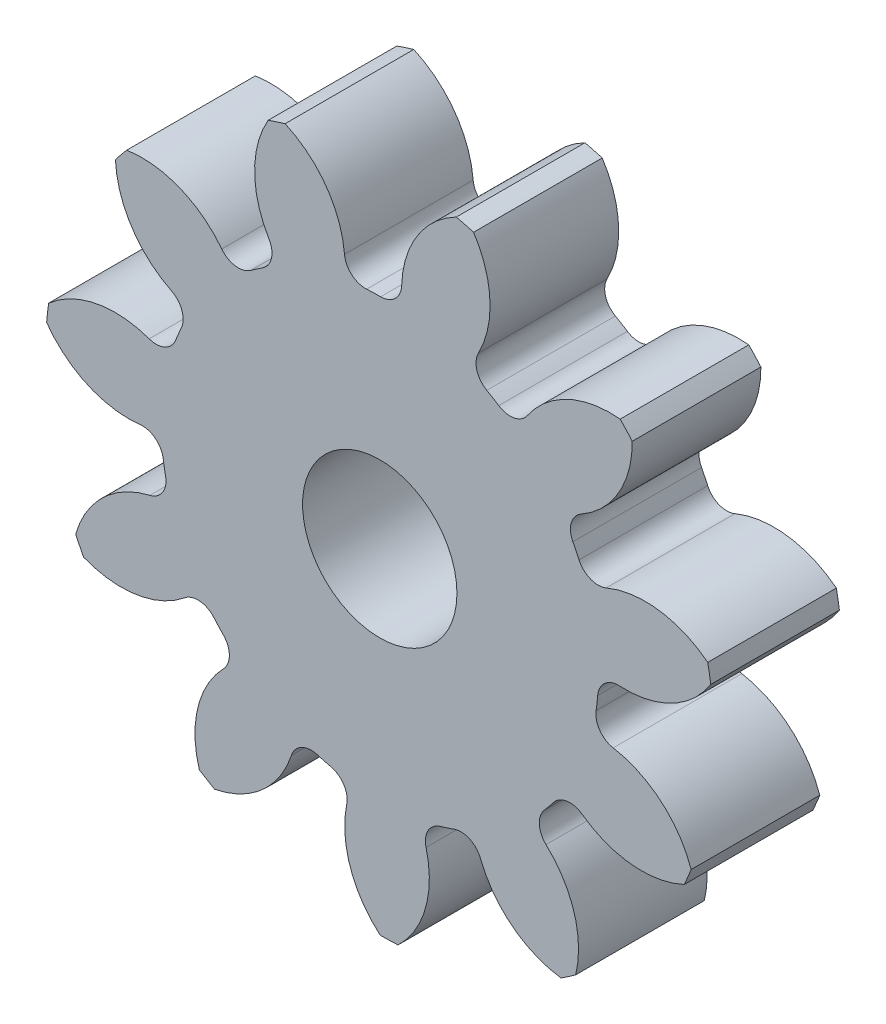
SolidWorks part; units mm, degrees
ref_plane "Front" through (0, 0, 0) normal (0, 0, 1) x (1, 0, 0)
ref_plane "Top" through (0, 0, 0) normal (0, 1, 0) x (1, 0, 0)
ref_plane "Right" through (0, 0, 0) normal (1, 0, 0) x (0, 0, -1)
sketch "Sketch3" plane through (0, 0, 0) normal (0, 0, 1) x (1, 0, 0)
  circle A0 centre (0, 0) radius 330.2
  dimension "od" = 660.4
extrude "gearBody" add sketch "Sketch3" along normal blind 127
sketch "Sketch2" plane through (0, 0, 0) normal (0, 0, 1) x (1, 0, 0)
  line L0 (0, 0) -> (242.5647, 100.4736) construction
  line L1 (309.4034, -127.0438) -> (0, 0) construction
  line L2 (0, 0) -> (36.3143, 0) construction
  line L3 (279.2866, 7.9593) -> (270.1426, -71.3254) construction
  line L5 (274.7146, -31.6831) -> (0, 0) construction
  line L7 (0, 0) -> (262.5501, 0) construction
  arc A0 (262.5334, 2.9613) -> (254.967, -62.6451) centre (0, 0) ccw construction
  arc A1 (326.7783, 47.4127) -> (307.4066, -120.5538) centre (0, 0) ccw construction
  arc A2 (279.2866, 7.9593) -> (270.1426, -71.3254) centre (0, 0) ccw construction
  arc A3 (213.5736, -31.6091) -> (215.1619, -17.8374) centre (0, 0) ccw
  arc A4 (309.4034, -127.0438) -> (230.466, -55.0028) centre (213.3254, -153.0518) ccw
  arc A5 (309.4034, -127.0438) -> (330.2, 53.2778) centre (0, 0) ccw
  arc A6 (330.2, 53.2778) -> (236.936, 1.097) centre (242.5647, 100.4736) cw
  arc A7 (215.1619, -17.8374) -> (236.936, 1.097) centre (235.7668, -19.5456) cw
  arc A8 (230.466, -55.0028) -> (213.5736, -31.6091) centre (234.0264, -34.6361) cw
  point P6 (330.2, 53.2778)
  point P22 (309.4034, -127.0438)
  dimension "baseDia" = 525.1002
  dimension "od" = 660.4
  dimension "pd" = 558.8
  dimension "rd" = 431.8
  dimension "rFillet" = 20.6756
  dimension "pointX" = 330.2
  dimension "pointY" = 53.2778
  dimension "CTT" = 79.2847
  dimension "flankCenterAngle" = 22.5
extrude "toothCut" cut sketch "Sketch2" along normal through all
pattern_circular "CirPattern1" count 11 over 360 about axis through (0, 0, 0) along (0, 0, 1) of "toothCut"
sketch "hub1Dia" plane through (0, 0, 0) normal (0, 0, -1) x (-1, 0, 0)
  circle A0 centre (0, 0) radius 12.7
  dimension "hub1Dia" = 25.4
sketch "hub2Dia" plane through (0, 0, 127) normal (0, 0, 1) x (1, 0, 0)
  circle A0 centre (0, 0) radius 12.7
  dimension "hub2dia" = 25.4
sketch "boreDia" plane through (0, 0, 0) normal (0, 0, 1) x (1, 0, 0)
  circle A0 centre (0, 0) radius 76.2
  dimension "boreDia" = 152.4
extrude "bore" cut sketch "boreDia" against normal mid plane 25400
